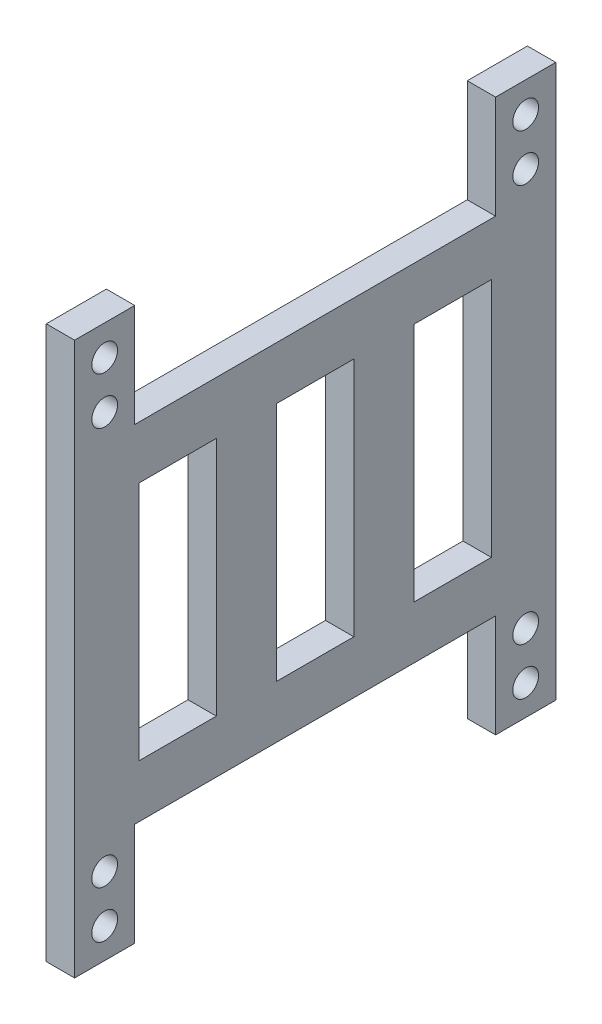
SolidWorks part; units mm, degrees
ref_plane "Front Plane" through (0, 0, 0) normal (0, 0, 1) x (1, 0, 0)
ref_plane "Top Plane" through (0, 0, 0) normal (0, 1, 0) x (1, 0, 0)
ref_plane "Right Plane" through (0, 0, 0) normal (1, 0, 0) x (0, 0, -1)
sketch "Sketch2" plane through (0, 0, 0) normal (1, 0, 0) x (0, 0, -1)
  line L0 (-28, 0) -> (31.8543, 0)
  line L1 (-28, -20.145) -> (28, -20.145)
  line L2 (-28, -20.145) -> (-28, 20.145)
  line L3 (-28, 20.145) -> (28, 20.145)
  line L4 (28, -20.145) -> (28, 20.145)
  line L5 (-28, -20.145) -> (28, 20.145) construction
  line L6 (-28, 20.145) -> (28, -20.145) construction
  line L7 (-28, 20.145) -> (-21, 20.145)
  line L8 (-28, 20.145) -> (-28, 32.145)
  line L9 (-28, 32.145) -> (-21, 32.145)
  line L10 (-21, 20.145) -> (-21, 32.145)
  line L11 (28, 20.145) -> (21, 20.145)
  line L12 (28, 20.145) -> (28, 32.145)
  line L13 (28, 32.145) -> (21, 32.145)
  line L14 (21, 20.145) -> (21, 32.145)
  line L15 (28, -20.145) -> (21, -20.145)
  line L16 (28, -20.145) -> (28, -32.145)
  line L17 (28, -32.145) -> (21, -32.145)
  line L18 (21, -20.145) -> (21, -32.145)
  line L19 (-28, -20.145) -> (-21, -20.145)
  line L20 (-28, -20.145) -> (-28, -32.145)
  line L21 (-28, -32.145) -> (-21, -32.145)
  line L22 (-21, -20.145) -> (-21, -32.145)
  line L23 (0, 32.8931) -> (0, -31.5654)
  circle A9 centre (-24.5, 28.645) radius 1.5
  circle A10 centre (-24.5, 23.145) radius 1.5
  circle A11 centre (24.5, 23.145) radius 1.5
  circle A12 centre (24.5, 28.645) radius 1.5
  circle A13 centre (24.5, -23.145) radius 1.5
  circle A14 centre (24.5, -28.645) radius 1.5
  circle A15 centre (-24.5, -23.145) radius 1.5
  circle A16 centre (-24.5, -28.645) radius 1.5
  circle A17 centre (0, 4.0422) radius 0.9144
  point P0 (0, 0)
  dimension "D13" = 3.5
  dimension "D14" = 5.5
  dimension "D11" = 3
  dimension "D12" = 3
  dimension "D1" = 40.29
  dimension "D2" = 56
  dimension "D3" = 12
  dimension "D4" = 12
  dimension "D5" = 12
  dimension "D6" = 12
  dimension "D7" = 7
  dimension "D8" = 7
  dimension "D9" = 7
  dimension "D10" = 7
extrude "Boss-Extrude1" add sketch "Sketch2" along normal blind 3.3
sketch "Sketch3" plane through (3.3, 0, 0) normal (1, 0, 0) x (0, 0, -1)
  line L0 (-28, 0) -> (31.8543, 0) construction
  line L1 (-4.5, -14) -> (4.5, -14)
  line L2 (-4.5, -14) -> (-4.5, 14)
  line L3 (-4.5, 14) -> (4.5, 14)
  line L4 (4.5, -14) -> (4.5, 14)
  line L5 (-4.5, -14) -> (4.5, 14) construction
  line L6 (-4.5, 14) -> (4.5, -14) construction
  line L7 (11.5, -14) -> (20.5, -14)
  line L8 (11.5, -14) -> (11.5, 14)
  line L9 (11.5, 14) -> (20.5, 14)
  line L10 (20.5, -14) -> (20.5, 14)
  line L11 (11.5, -14) -> (20.5, 14) construction
  line L12 (11.5, 14) -> (20.5, -14) construction
  line L14 (-20.5, -14) -> (-11.5, -14)
  line L15 (-20.5, -14) -> (-20.5, 14)
  line L16 (-20.5, 14) -> (-11.5, 14)
  line L17 (-11.5, -14) -> (-11.5, 14)
  line L18 (-20.5, -14) -> (-11.5, 14) construction
  line L19 (-20.5, 14) -> (-11.5, -14) construction
  point P0 (0, 0)
  point P6 (16, 0)
  point P13 (-16, 0)
  dimension "D1" = 9
  dimension "D2" = 28
  dimension "D3" = 7
  dimension "D4" = 7
extrude "Cut-Extrude1" cut sketch "Sketch3" against normal blind 10
